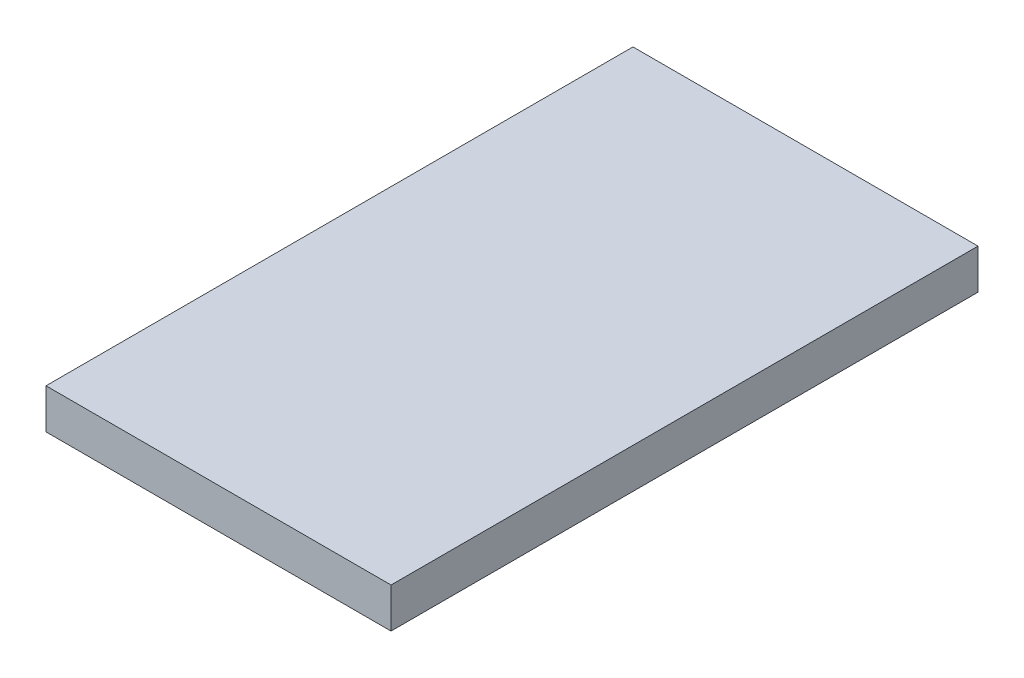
SolidWorks part; units mm, degrees
ref_plane "Front Plane" through (0, 0, 0) normal (0, 0, 1) x (1, 0, 0)
ref_plane "Top Plane" through (0, 0, 0) normal (0, 1, 0) x (1, 0, 0)
ref_plane "Right Plane" through (0, 0, 0) normal (1, 0, 0) x (0, 0, -1)
sketch "Sketch1" plane through (0, 0, 0) normal (0, 0, 1) x (1, 0, 0)
  line L7 (-30.861, -3.5719) -> (30.861, -3.5719)
  line L8 (-30.861, -3.5719) -> (-30.861, 3.5719)
  line L9 (-30.861, 3.5719) -> (30.861, 3.5719)
  line L10 (30.861, -3.5719) -> (30.861, 3.5719)
  line L11 (-30.861, -3.5719) -> (30.861, 3.5719) construction
  line L12 (-30.861, 3.5719) -> (30.861, -3.5719) construction
  point P4 (0, 0)
  point P14 (0, 0)
sketch "Sketch2" plane through (0, 0, 0) normal (0, 1, 0) x (0, 0, -1)
  line L0 (52.5, 30.861) -> (-52.5, 30.861) construction
  point P0 (24.6525, 30.861)
  point P4 (0, 30.861)
  point P6 (-24.6525, 30.861)
sketch "Sketch3" plane through (0, 0, 0) normal (0, 0, 1) x (1, 0, 0)
  line L6 (-30.861, 3.5719) -> (30.861, 3.5719)
  line L7 (30.861, 3.5719) -> (30.861, -3.5719)
  line L8 (30.861, -3.5719) -> (-30.861, -3.5719)
  line L9 (-30.861, -3.5719) -> (-30.861, 3.5719)
extrude "Boss-Extrude1" add sketch "Sketch3" along normal mid plane 105
equation "\"D1@Boss-Extrude1\" = \"Length@Sketch2\""
equation "\"D1@Sketch2\"=\"Width@Sketch1\" * 1.25"
equation "\"D2@Sketch2\"=\"D1@Sketch2\""
